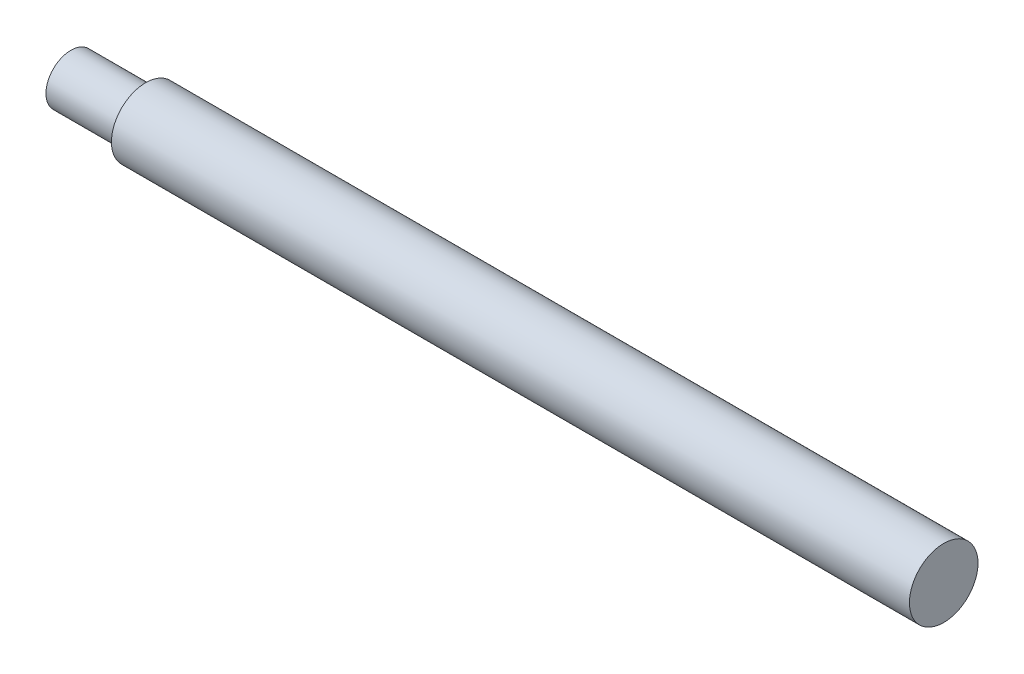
SolidWorks part; units mm, degrees
ref_plane "front" through (0, 0, 0) normal (0, 0, 1) x (1, 0, 0)
ref_plane "top" through (0, 0, 0) normal (0, 1, 0) x (1, 0, 0)
ref_plane "side" through (0, 0, 0) normal (1, 0, 0) x (0, 0, -1)
sketch "Sketch1" plane through (0, 0, 0) normal (1, 0, 0) x (0, 0, -1)
  circle A0 centre (0, 0) radius 17.4625
  dimension "D1" = 34.925
extrude "Base-Extrude" add sketch "Sketch1" against normal blind 406.4
sketch "Sketch2" plane through (-406.4, 0, 0) normal (-1, 0, 0) x (0, 0, 1)
  circle A0 centre (0, 0) radius 12.7
  dimension "D1" = 25.4
extrude "Boss-Extrude1" add sketch "Sketch2" along normal blind 38.1
